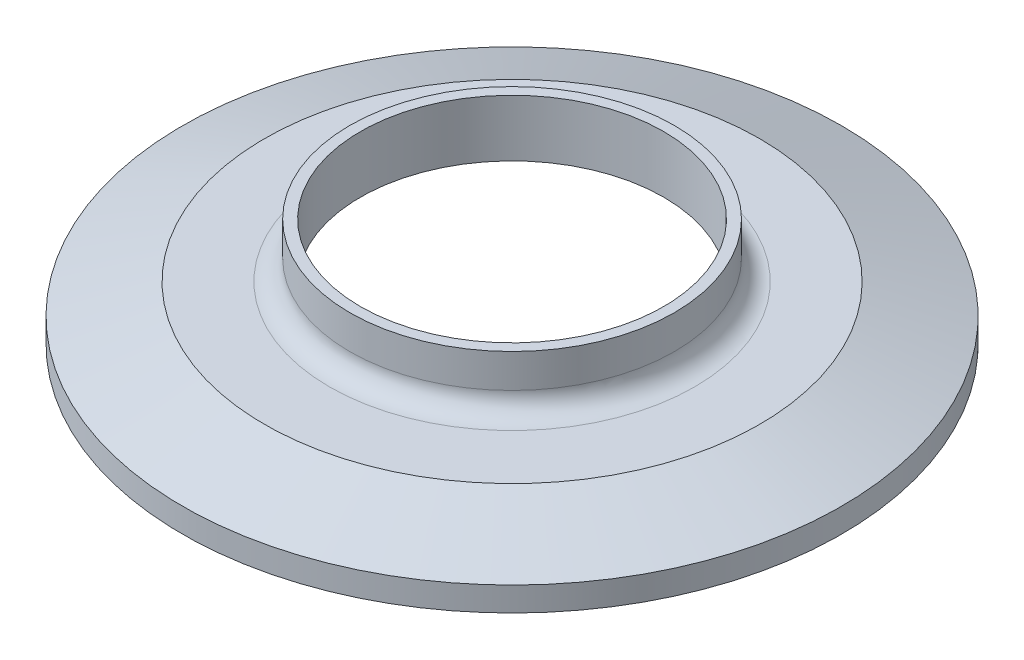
SolidWorks part; units mm, degrees
ref_plane "Front Plane" through (0, 0, 0) normal (0, 0, 1) x (1, 0, 0)
ref_plane "Top Plane" through (0, 0, 0) normal (0, 1, 0) x (1, 0, 0)
ref_plane "Right Plane" through (0, 0, 0) normal (1, 0, 0) x (0, 0, -1)
sketch "Sketch1" plane through (0, 0, 0) normal (0, 0, 1) x (1, 0, 0)
  line L0 (0, 0) -> (0, 8.8532) construction
  line L1 (-19.05, 12.7) -> (-19.05, 8.7376)
  line L2 (-21.4376, 6.35) -> (-29.0664, 6.35)
  line L3 (-29.0664, 6.35) -> (-38.6969, 2.8448)
  line L4 (-38.6969, 2.8448) -> (-38.6969, 0)
  line L5 (-38.6969, 0) -> (-36.9029, 0.0025)
  line L6 (-30.099, 0) -> (-33.6725, -0.1437)
  line L10 (-30.099, 0) -> (-17.8054, 6.0226)
  line L11 (-17.8054, 6.0226) -> (-17.8054, 12.7)
  line L12 (-17.8054, 12.7) -> (-19.05, 12.7)
  line L15 (-36.0732, 0.7292) -> (-36.1781, 0.4823)
  line L17 (-34.5642, 0.7292) -> (-34.3973, 0.3361)
  arc A0 (-21.4376, 6.35) -> (-19.05, 8.7376) centre (-21.4376, 8.7376) ccw
  arc A1 (-36.1781, 0.4823) -> (-36.9029, 0.0025) centre (-36.9029, 0.7899) cw
  arc A2 (-33.6725, -0.1437) -> (-34.3973, 0.3361) centre (-33.6725, 0.6437) cw
  arc A3 (-34.5642, 0.7292) -> (-36.0732, 0.7292) centre (-35.3187, 0.4089) ccw
  dimension "D3" = 2.3876
  dimension "D7" = 0.7874
  dimension "D8" = 35.3187
  dimension "D9" = 0.7874
  dimension "D2" = 17.8054
  dimension "D4" = 12.7
  dimension "D5" = 6.35
  dimension "D6" = 38.6969
  dimension "D10" = 20
  dimension "D11" = 30.099
  dimension "D12" = 19.05
  dimension "D13" = 2.8448
  dimension "D14" = 63.9
revolve "Revolve1" add sketch "Sketch1" angle 360 about L0
